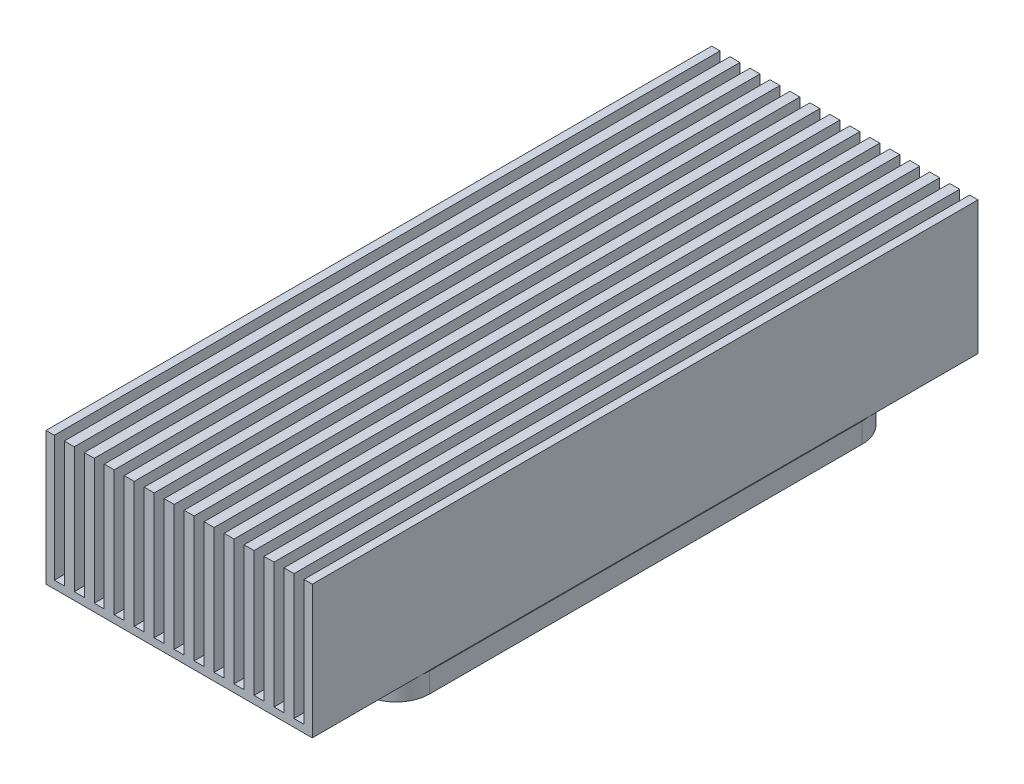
SolidWorks part; units mm, degrees
ref_plane "Front Plane" through (0, 0, 0) normal (0, 0, 1) x (1, 0, 0)
ref_plane "Top Plane" through (0, 0, 0) normal (0, 1, 0) x (1, 0, 0)
ref_plane "Right Plane" through (0, 0, 0) normal (1, 0, 0) x (0, 0, -1)
sketch "Esquisse1" plane through (0, 0, 0) normal (0, 0, 1) x (1, 0, 0)
  line L0 (-20, 20) -> (-18.75, 20)
  line L1 (-18.75, 20) -> (-18.75, 1.1475)
  line L2 (-20, 20) -> (-20, 0)
  line L3 (-20, 0) -> (20, 0)
  line L4 (20, 20) -> (20, 0)
  line L5 (-18.75, 1.1475) -> (-17.25, 1.1475)
  line L6 (-17.25, 1.1475) -> (-17.25, 20)
  line L7 (-17.25, 20) -> (-15.75, 20)
  line L8 (-15.75, 20) -> (-15.75, 1.1475)
  line L9 (-15.75, 1.1475) -> (-14.25, 1.1475)
  line L10 (-14.25, 1.1475) -> (-14.25, 20)
  line L11 (-14.25, 20) -> (-12.75, 20)
  line L12 (-12.75, 20) -> (-12.75, 1.1475)
  line L13 (-12.75, 1.1475) -> (-11.25, 1.1475)
  line L14 (-11.25, 1.1475) -> (-11.25, 20)
  line L15 (-11.25, 20) -> (-9.75, 20)
  line L16 (-9.75, 20) -> (-9.75, 1.1475)
  line L17 (-9.75, 1.1475) -> (-8.25, 1.1475)
  line L18 (-8.25, 1.1475) -> (-8.25, 20)
  line L19 (-8.25, 20) -> (-6.75, 20)
  line L20 (-6.75, 20) -> (-6.75, 1.1475)
  line L21 (-6.75, 1.1475) -> (-5.25, 1.1475)
  line L22 (-5.25, 1.1475) -> (-5.25, 20)
  line L23 (-5.25, 20) -> (-3.75, 20)
  line L24 (-3.75, 20) -> (-3.75, 1.1475)
  line L25 (-3.75, 1.1475) -> (-2.25, 1.1475)
  line L26 (-2.25, 1.1475) -> (-2.25, 20)
  line L27 (-2.25, 20) -> (-0.75, 20)
  line L28 (-0.75, 20) -> (-0.75, 1.1475)
  line L29 (-0.75, 1.1475) -> (0.75, 1.1475)
  line L30 (0.75, 1.1475) -> (0.75, 20)
  line L31 (0.75, 20) -> (2.25, 20)
  line L32 (2.25, 20) -> (2.25, 1.1475)
  line L33 (2.25, 1.1475) -> (3.75, 1.1475)
  line L34 (3.75, 1.1475) -> (3.75, 20)
  line L35 (3.75, 20) -> (5.25, 20)
  line L36 (5.25, 20) -> (5.25, 1.1475)
  line L37 (5.25, 1.1475) -> (6.75, 1.1475)
  line L38 (6.75, 1.1475) -> (6.75, 20)
  line L39 (6.75, 20) -> (8.25, 20)
  line L40 (8.25, 20) -> (8.25, 1.1475)
  line L41 (8.25, 1.1475) -> (9.75, 1.1475)
  line L42 (9.75, 1.1475) -> (9.75, 20)
  line L43 (9.75, 20) -> (11.25, 20)
  line L44 (11.25, 20) -> (11.25, 1.1475)
  line L45 (11.25, 1.1475) -> (12.75, 1.1475)
  line L46 (12.75, 1.1475) -> (12.75, 20)
  line L47 (12.75, 20) -> (14.25, 20)
  line L48 (14.25, 20) -> (14.25, 1.1475)
  line L49 (14.25, 1.1475) -> (15.75, 1.1475)
  line L50 (15.75, 1.1475) -> (15.75, 20)
  line L51 (15.75, 20) -> (17.25, 20)
  line L52 (17.25, 20) -> (17.25, 1.1475)
  line L53 (17.25, 1.1475) -> (18.75, 1.1475)
  line L54 (18.75, 1.1475) -> (18.75, 20)
  line L55 (18.75, 20) -> (20, 20)
  line L56 (18.75, 20) -> (20.25, 20)
  point P4 (0, 0)
  point P10 (20, 19.8888)
  dimension "D1" = 40
  dimension "D2" = 20
  dimension "D3" = 1.5
  dimension "D4" = 13
extrude "Boss.-Extru.1" add sketch "Esquisse1" along normal mid plane 100
sketch "Esquisse2" plane through (0, 0, 0) normal (0, -1, 0) x (1, 0, 0)
  line L1 (-15.1, -37.5) -> (15.1, -37.5)
  line L2 (-20.1, -32.5) -> (-20.1, 32.5)
  line L3 (-15.1, 37.5) -> (15.1, 37.5)
  line L4 (20.1, -32.5) -> (20.1, 32.5)
  arc A0 (15.1, 37.5) -> (20.1, 32.5) centre (15.1, 32.5) cw
  arc A1 (20.1, -32.5) -> (15.1, -37.5) centre (15.1, -32.5) cw
  arc A2 (-20.1, -32.5) -> (-15.1, -37.5) centre (-15.1, -32.5) ccw
  arc A3 (-15.1, 37.5) -> (-20.1, 32.5) centre (-15.1, 32.5) ccw
  point P0 (0, 0)
  point P1 (-10.6538, 37.6895)
  point P2 (0, 37.5)
  point P3 (20.2, 32.6895)
  point P4 (20.1, 0)
  dimension "D3" = 5
  dimension "D1" = 75
  dimension "D2" = 40.2
extrude "Support" add sketch "Esquisse2" along normal blind 3
sketch "Esquisse3" plane through (0, -3, 0) normal (0, -1, 0) x (1, 0, 0)
  line L1 (12.5, 12.5) -> (-12.5, 12.5)
  line L2 (12.5, 12.5) -> (12.5, -12.5)
  line L3 (12.5, -12.5) -> (-12.5, -12.5)
  line L4 (-12.5, 12.5) -> (-12.5, -12.5)
  line L5 (12.5, 12.5) -> (-12.5, -12.5) construction
  line L6 (12.5, -12.5) -> (-12.5, 12.5) construction
  point P0 (0, 0)
  point P6 (0, 0)
  dimension "D1" = 25
extrude "Led" add sketch "Esquisse3" along normal blind 1
sketch "Esquisse4" plane through (0, -3, -3) normal (0, 1, 0) x (-1, 0, 0)
  line L7 (-17, -14) -> (17, -14) construction
  line L8 (-17, -14) -> (-17, 20) construction
  line L9 (-17, 20) -> (17, 20) construction
  line L10 (17, -14) -> (17, 20) construction
  line L11 (-17, -14) -> (17, 20) construction
  line L12 (-17, 20) -> (17, -14) construction
  circle A0 centre (17, 20) radius 1.5
  circle A1 centre (17, -14) radius 1.5
  circle A2 centre (-17, -14) radius 1.5
  circle A3 centre (-17, 20) radius 1.5
  point P0 (-21.5752, -16.5337)
  point P1 (-0.638, -2.3504)
  point P2 (0, 0)
  point P3 (0, 3)
  dimension "D3" = 3
  dimension "D2" = 34
extrude "Enlèv. mat.-Extru.3" cut sketch "Esquisse4" along normal blind 20
sketch "Esquisse5" plane through (0, -3, 0) normal (0, -1, 0) x (1, 0, 0)
  line L1 (32.5, 46) -> (-32.5, 46)
  line L2 (32.5, 46) -> (32.5, -46)
  line L3 (32.5, -46) -> (-32.5, -46)
  line L4 (-32.5, 46) -> (-32.5, -46)
  point P4 (0, 0)
  point P6 (0, 46)
  point P8 (-32.5, 0)
  dimension "D1" = 92
  dimension "D2" = 65
